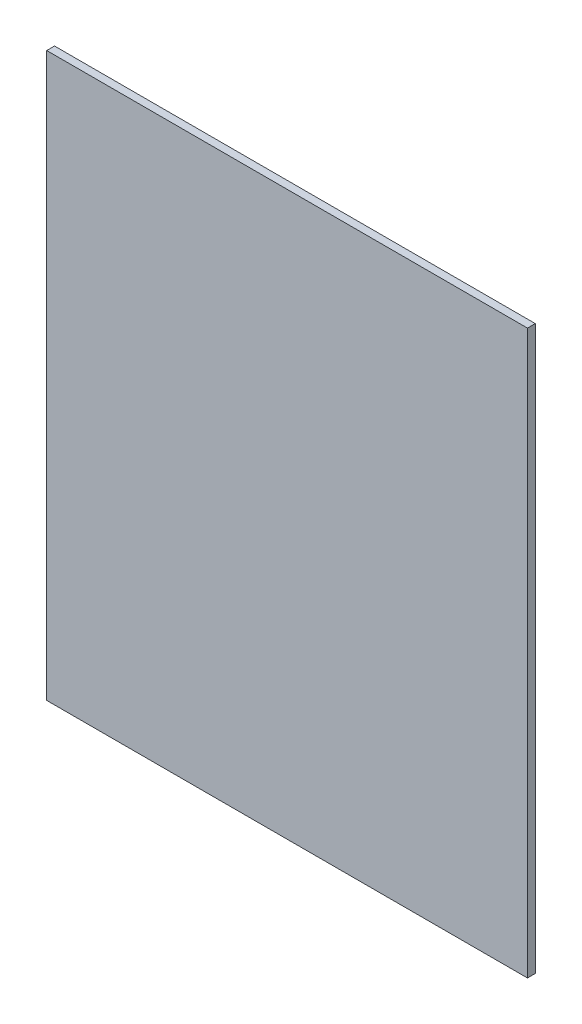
SolidWorks part; units mm, degrees
ref_plane "Plan de face" through (0, 0, 0) normal (0, 0, 1) x (1, 0, 0)
ref_plane "Plan de dessus" through (0, 0, 0) normal (0, 1, 0) x (1, 0, 0)
ref_plane "Plan de droite" through (0, 0, 0) normal (1, 0, 0) x (0, 0, -1)
sketch "Esquisse1" plane through (0, 0, 0) normal (0, 0, 1) x (1, 0, 0)
  line L0 (615, 720) -> (0, 720)
  line L1 (0, 0) -> (615, 0)
  line L2 (0, 0) -> (0, 720)
  line L4 (615, 0) -> (615, 720)
  dimension "D1" = 615
  dimension "D2" = 720
extrude "Extrusion1" add sketch "Esquisse1" along normal blind 10
